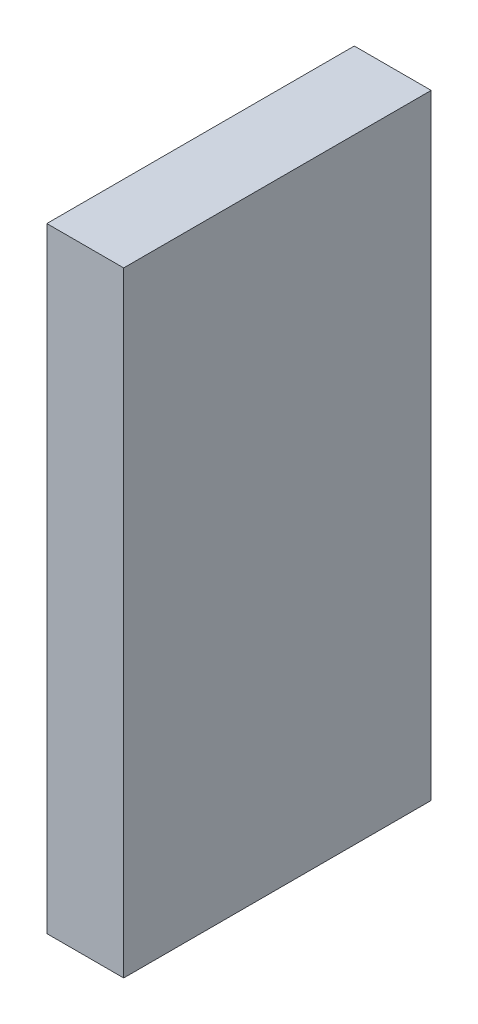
SolidWorks part; units mm, degrees
ref_plane "Front Plane" through (0, 0, 0) normal (0, 0, 1) x (1, 0, 0)
ref_plane "Top Plane" through (0, 0, 0) normal (0, 1, 0) x (1, 0, 0)
ref_plane "Right Plane" through (0, 0, 0) normal (1, 0, 0) x (0, 0, -1)
sketch "Sketch1" plane through (0, 0, 0) normal (0, 0, 1) x (1, 0, 0)
  line L1 (14.5217, 27.7339) -> (17.0217, 27.7339)
  line L2 (14.5217, 27.7339) -> (14.5217, 7.7339)
  line L3 (14.5217, 7.7339) -> (17.0217, 7.7339)
  line L4 (17.0217, 27.7339) -> (17.0217, 7.7339)
  dimension "D1" = 2.5
extrude "Extrude1" add sketch "Sketch1" against normal up to surface (10 mm away)
